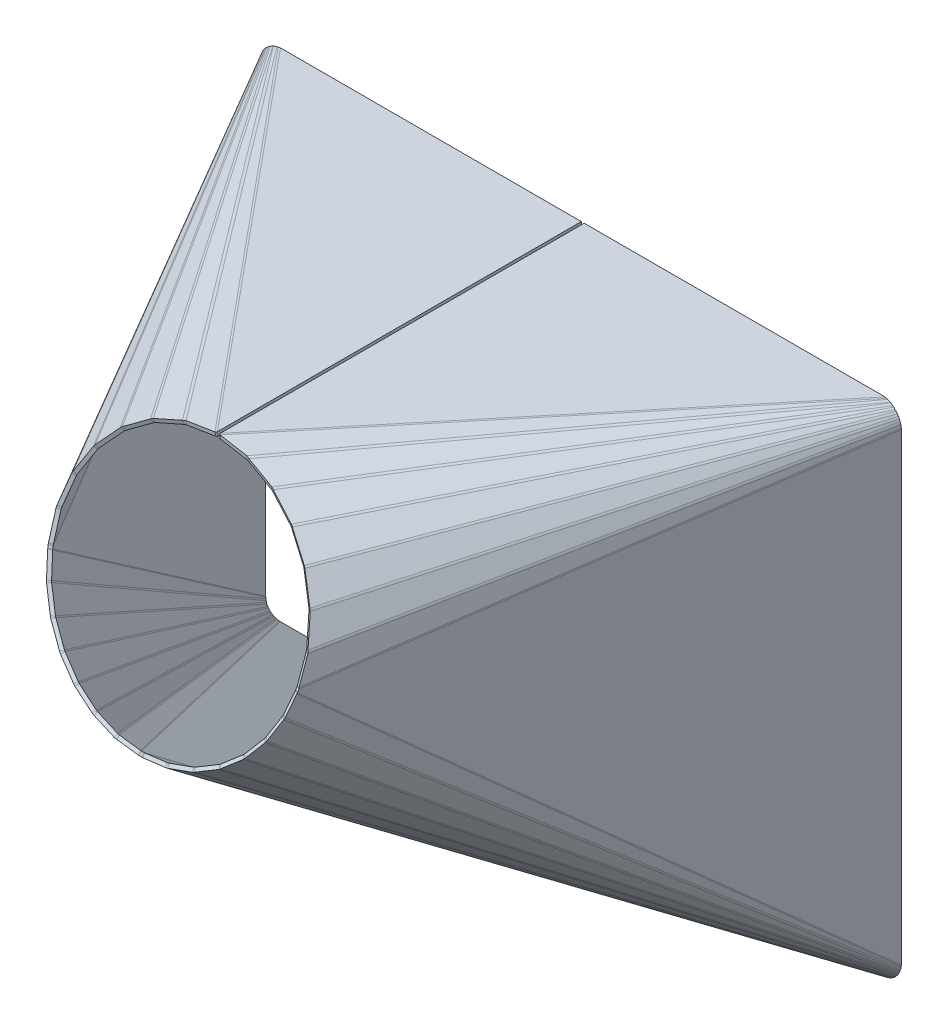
SolidWorks part; units mm, degrees
ref_plane "Front Plane" through (0, 0, 0) normal (0, 0, 1) x (1, 0, 0)
ref_plane "Top Plane" through (0, 0, 0) normal (0, 1, 0) x (1, 0, 0)
ref_plane "Right Plane" through (0, 0, 0) normal (1, 0, 0) x (0, 0, -1)
sketch "Rect Profile" plane through (0, 0, 0) normal (0, 0, 1) x (1, 0, 0)
  line L0 (1, 175) -> (225, 175)
  line L1 (-225, -175) -> (225, -175)
  line L2 (-225, -175) -> (-225, 175)
  line L3 (-225, 175) -> (-1, 175)
  line L4 (225, -175) -> (225, 175)
  line L5 (0, 175) -> (0, -175) construction
  line L6 (-225, 0) -> (225, 0) construction
  point P0 (0, 0)
sketch "Locating Sketch" plane through (0, 0, 0) normal (1, 0, 0) x (0, 0, -1)
  line L0 (0, 0) -> (-285.6459, 91.6866) construction
  line L1 (0, 175) -> (0, -175) construction
  line L2 (-312.3878, 8.3732) -> (-258.9039, 175) construction
  line L3 (-258.9039, 175) -> (0, 175) construction
  line L4 (0, -175) -> (0, 175) construction
  line L5 (0, -175) -> (0, 175) construction
ref_plane "Plane1" through (0, 91.6866, 285.6459) normal (0, 0.3056, 0.9522) x (1, 0, 0)
sketch "Circ Profile" plane through (0, 91.6866, 285.6459) normal (0, 0.3056, 0.9522) x (1, 0, 0)
  line L0 (0, 0) -> (0, 87.5) construction
  arc A0 (-1, 87.4943) -> (1, 87.4943) centre (0, 0) ccw
lofted bend "Lofted Bends1" parameters "D1"=0, "D13"=0.5, "D15"=5, "D16"=30, "D17"=0.5, "D19"=5, "D20"=30, "D21"=0.5, "D23"=5, "D24"=30, "D25"=0.5, "D27"=5, "D28"=30, "D29"=0.5, "D31"=5, "D32"=30
bend "RoundBend1" bend radius 5.08 bend angle 9.095 parameters "D5"=1
bend "RoundBend2" bend radius 5.08 bend angle 7.445 parameters "D5"=2
bend "RoundBend3" bend radius 5.08 bend angle 13.178 parameters "D5"=3
bend "RoundBend4" bend radius 5.08 bend angle 11.727 parameters "D5"=4
bend "RoundBend5" bend radius 5.08 bend angle 11.137 parameters "D5"=5
bend "RoundBend6" bend radius 5.08 bend angle 11.383 parameters "D5"=6
bend "RoundBend7" bend radius 5.08 bend angle 12.49 parameters "D5"=7
bend "RoundBend8" bend radius 5.08 bend angle 14.48 parameters "D5"=8
bend "RoundBend9" bend radius 5.08 bend angle 5.498 parameters "D5"=9
bend "RoundBend10" bend radius 5.08 bend angle 6.52 parameters "D5"=10
bend "RoundBend11" bend radius 5.08 bend angle 12.263 parameters "D5"=11
bend "RoundBend12" bend radius 5.08 bend angle 11.382 parameters "D5"=12
bend "RoundBend13" bend radius 5.08 bend angle 10.726 parameters "D5"=13
bend "RoundBend14" bend radius 5.08 bend angle 10.362 parameters "D5"=14
bend "RoundBend15" bend radius 5.08 bend angle 10.314 parameters "D5"=15
bend "RoundBend16" bend radius 5.08 bend angle 10.588 parameters "D5"=16
bend "RoundBend17" bend radius 5.08 bend angle 6.52 parameters "D5"=17
bend "RoundBend18" bend radius 5.08 bend angle 5.5 parameters "D5"=18
bend "RoundBend19" bend radius 5.08 bend angle 10.588 parameters "D5"=19
bend "RoundBend20" bend radius 5.08 bend angle 10.314 parameters "D5"=20
bend "RoundBend21" bend radius 5.08 bend angle 10.362 parameters "D5"=21
bend "RoundBend22" bend radius 5.08 bend angle 10.726 parameters "D5"=22
bend "RoundBend23" bend radius 5.08 bend angle 11.382 parameters "D5"=23
bend "RoundBend24" bend radius 5.08 bend angle 12.263 parameters "D5"=24
bend "RoundBend25" bend radius 5.08 bend angle 7.446 parameters "D5"=25
bend "RoundBend26" bend radius 5.08 bend angle 9.095 parameters "D5"=26
bend "RoundBend27" bend radius 5.08 bend angle 14.48 parameters "D5"=27
bend "RoundBend28" bend radius 5.08 bend angle 12.49 parameters "D5"=28
bend "RoundBend29" bend radius 5.08 bend angle 11.383 parameters "D5"=29
bend "RoundBend30" bend radius 5.08 bend angle 11.137 parameters "D5"=30
bend "RoundBend31" bend radius 5.08 bend angle 11.727 parameters "D5"=31
bend "RoundBend32" bend radius 5.08 bend angle 13.178 parameters "D5"=32
sketch "Bend-Lines1" [suppressed] plane through (0, 0, 0) normal (0, 1, 0) x (1, 0, 0)
sketch "Bounding-Box1" [suppressed] plane through (0, 0, 0) normal (0, 1, 0) x (1, 0, 0)
sheet metal parameters "Sheet-Metal2" thickness 2.6568 parameters "D1"=5.08
flat pattern "Flat-Pattern2"
sketch "Bend-Lines2" plane through (0, -130.1068, 76.4259) normal (0, 0.8622, -0.5065) x (1, 0, 0)
  line L0 (-136.8857, -320.0981) -> (-429.4063, -185.7305) construction
  line L1 (-152.323, -335.0984) -> (-430.587, -188.109) construction
  line L2 (-165.5302, -352.0821) -> (-431.5, -190.4753) construction
  line L3 (-176.1483, -370.7919) -> (-432.1399, -192.5845) construction
  line L4 (-184.0085, -390.8249) -> (-432.6705, -194.8167) construction
  line L5 (-189.1912, -411.7257) -> (-433.1061, -196.9863) construction
  line L6 (-192.3451, -432.7037) -> (-433.4892, -199.4236) construction
  line L7 (-120.6545, -307.8229) -> (-427.7767, -183.1249) construction
  line L8 (-18.0214, -274.2026) -> (-217.5094, 88.3044) construction
  line L9 (-35.9788, -275.9314) -> (-220.2841, 87.6484) construction
  line L10 (-53.7407, -279.0562) -> (-222.8285, 86.6536) construction
  line L11 (-71.1543, -283.7318) -> (-225.1657, 85.3371) construction
  line L12 (-88.0544, -290.0097) -> (-227.0769, 83.92) construction
  line L13 (-104.2914, -297.8468) -> (-228.7276, 82.4063) construction
  line L14 (-118.5817, -306.4051) -> (-230.0209, 81.0086) construction
  line L15 (-1.1527, -273.6627) -> (-214.9758, 88.5875) construction
  line L16 (228.7276, 82.4063) -> (104.2915, -297.8468) construction
  line L17 (227.0769, 83.92) -> (88.0544, -290.0097) construction
  line L18 (225.1657, 85.3371) -> (71.1543, -283.7318) construction
  line L19 (222.8286, 86.6536) -> (53.7407, -279.0562) construction
  line L20 (220.2841, 87.6484) -> (35.9788, -275.9314) construction
  line L21 (217.5094, 88.3044) -> (18.0214, -274.2026) construction
  line L22 (214.9758, 88.5875) -> (1.1527, -273.6627) construction
  line L23 (230.0209, 81.0085) -> (118.3595, -306.2709) construction
  line L24 (433.1052, -196.987) -> (189.1888, -411.7248) construction
  line L25 (432.6696, -194.8174) -> (184.0062, -390.8238) construction
  line L26 (432.1391, -192.5851) -> (176.1462, -370.7906) construction
  line L27 (431.4992, -190.4759) -> (165.5282, -352.0807) construction
  line L28 (430.5862, -188.1096) -> (152.3212, -335.0969) construction
  line L29 (429.4055, -185.731) -> (136.8839, -320.0965) construction
  line L30 (427.7759, -183.1255) -> (120.8261, -307.9503) construction
  line L31 (433.4883, -199.4242) -> (192.3424, -432.7024) construction
  line L32 (-136.8857, -320.0981) -> (-429.4063, -185.7305) construction
  line L33 (-152.323, -335.0984) -> (-430.587, -188.109) construction
  line L34 (-165.5302, -352.0821) -> (-431.5, -190.4753) construction
  line L35 (-176.1483, -370.7919) -> (-432.1399, -192.5845) construction
  line L36 (-184.0085, -390.8249) -> (-432.6705, -194.8167) construction
  line L37 (-189.1912, -411.7257) -> (-433.1061, -196.9863) construction
  line L38 (-192.3451, -432.7037) -> (-433.4892, -199.4236) construction
  line L39 (-120.6545, -307.8229) -> (-427.7767, -183.1249) construction
  line L40 (-18.0214, -274.2026) -> (-217.5094, 88.3044) construction
  line L41 (-35.9788, -275.9314) -> (-220.2841, 87.6484) construction
  line L42 (-53.7407, -279.0562) -> (-222.8285, 86.6536) construction
  line L43 (-71.1543, -283.7318) -> (-225.1657, 85.3371) construction
  line L44 (-88.0544, -290.0097) -> (-227.0769, 83.92) construction
  line L45 (-104.2914, -297.8468) -> (-228.7276, 82.4063) construction
  line L46 (-118.5817, -306.4051) -> (-230.0209, 81.0086) construction
  line L47 (-1.1527, -273.6627) -> (-214.9758, 88.5875) construction
  line L48 (228.7276, 82.4063) -> (104.2915, -297.8468) construction
  line L49 (227.0769, 83.92) -> (88.0544, -290.0097) construction
  line L50 (225.1657, 85.3371) -> (71.1543, -283.7318) construction
  line L51 (222.8286, 86.6536) -> (53.7407, -279.0562) construction
  line L52 (220.2841, 87.6484) -> (35.9788, -275.9314) construction
  line L53 (217.5094, 88.3044) -> (18.0214, -274.2026) construction
  line L54 (214.9758, 88.5875) -> (1.1527, -273.6627) construction
  line L55 (230.0209, 81.0085) -> (118.3595, -306.2709) construction
  line L56 (433.1052, -196.987) -> (189.1888, -411.7248) construction
  line L57 (432.6696, -194.8174) -> (184.0062, -390.8238) construction
  line L58 (432.1391, -192.5851) -> (176.1462, -370.7906) construction
  line L59 (431.4992, -190.4759) -> (165.5282, -352.0807) construction
  line L60 (430.5862, -188.1096) -> (152.3212, -335.0969) construction
  line L61 (429.4055, -185.731) -> (136.8839, -320.0965) construction
  line L62 (427.7759, -183.1255) -> (120.8261, -307.9503) construction
  line L63 (433.4883, -199.4242) -> (192.3424, -432.7024) construction
sketch3d "Bounding-Box2" [suppressed]
  line L0 (450.2482, 88.6359, 0) -> (-450.2507, 88.6359, 0) construction
  line L1 (450.2482, -433.0047, 0) -> (-450.2507, -433.0047, 0) construction
  line L2 (450.2482, 88.6359, 0) -> (450.2482, -433.0047, 0) construction
  line L3 (-450.2507, 88.6359, 0) -> (-450.2507, -433.0047, 0) construction
bend of the flat pattern "Flatten-<RoundBend1>1"
bend of the flat pattern "Flatten-<RoundBend2>1"
bend of the flat pattern "Flatten-<RoundBend3>1"
bend of the flat pattern "Flatten-<RoundBend4>1"
bend of the flat pattern "Flatten-<RoundBend5>1"
bend of the flat pattern "Flatten-<RoundBend6>1"
bend of the flat pattern "Flatten-<RoundBend7>1"
bend of the flat pattern "Flatten-<RoundBend8>1"
bend of the flat pattern "Flatten-<RoundBend9>1"
bend of the flat pattern "Flatten-<RoundBend10>1"
bend of the flat pattern "Flatten-<RoundBend11>1"
bend of the flat pattern "Flatten-<RoundBend12>1"
bend of the flat pattern "Flatten-<RoundBend13>1"
bend of the flat pattern "Flatten-<RoundBend14>1"
bend of the flat pattern "Flatten-<RoundBend15>1"
bend of the flat pattern "Flatten-<RoundBend16>1"
bend of the flat pattern "Flatten-<RoundBend17>1"
bend of the flat pattern "Flatten-<RoundBend18>1"
bend of the flat pattern "Flatten-<RoundBend19>1"
bend of the flat pattern "Flatten-<RoundBend20>1"
bend of the flat pattern "Flatten-<RoundBend21>1"
bend of the flat pattern "Flatten-<RoundBend22>1"
bend of the flat pattern "Flatten-<RoundBend23>1"
bend of the flat pattern "Flatten-<RoundBend24>1"
bend of the flat pattern "Flatten-<RoundBend25>1"
bend of the flat pattern "Flatten-<RoundBend26>1"
bend of the flat pattern "Flatten-<RoundBend27>1"
bend of the flat pattern "Flatten-<RoundBend28>1"
bend of the flat pattern "Flatten-<RoundBend29>1"
bend of the flat pattern "Flatten-<RoundBend30>1"
bend of the flat pattern "Flatten-<RoundBend31>1"
bend of the flat pattern "Flatten-<RoundBend32>1"
equation "\"GAP\"=2"
equation "\"D3@Rect Profile\" = \"GAP\""
equation "\"D2@Circ Profile\" = \"GAP\""
equation "\"Circ_Dia\"=175"
equation "\"D3@Locating Sketch\"=\"Circ_Dia\""
equation "\"D1@Circ Profile\"=\"Circ_Dia\""
